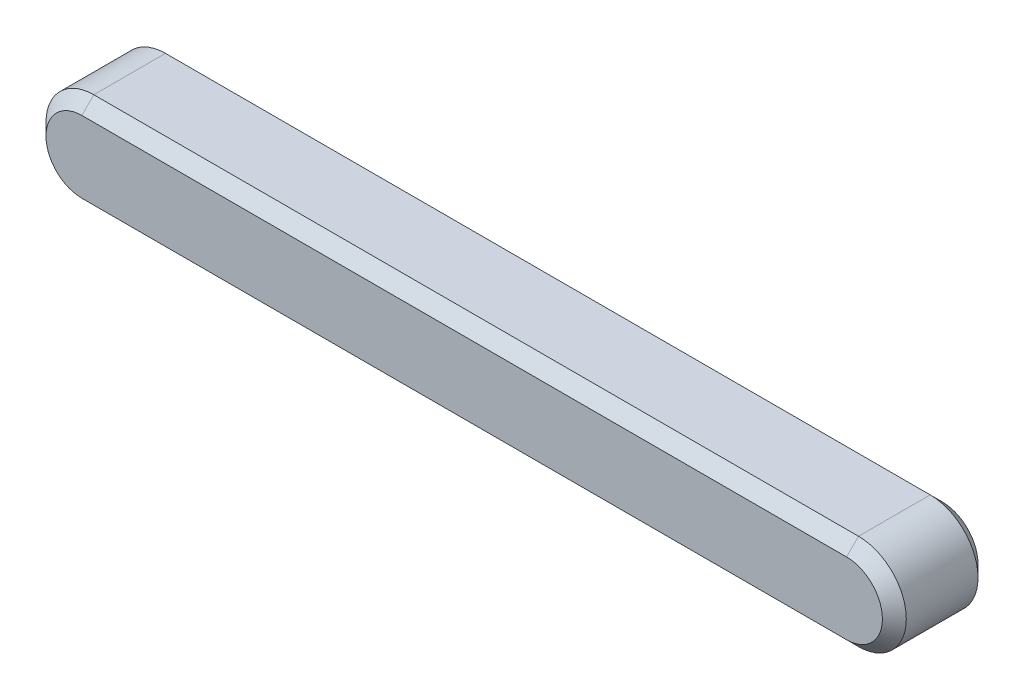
SolidWorks part; units mm, degrees
ref_plane "Front" through (0, 0, 0) normal (0, 0, 1) x (1, 0, 0)
ref_plane "Top" through (0, 0, 0) normal (0, 1, 0) x (1, 0, 0)
ref_plane "Right" through (0, 0, 0) normal (1, 0, 0) x (0, 0, -1)
other "Configuration Table"
sketch "body" plane through (0, 0, 0) normal (0, 0, 1) x (1, 0, 0)
  line L1 (0, 0) -> (16, 0)
  line L3 (0, 2) -> (16, 2)
  arc A0 (16, 0) -> (16, 2) centre (16, 1) ccw
  arc A1 (0, 0) -> (0, 2) centre (0, 1) cw
  dimension "Width" = 2
  dimension "Length" = 18
extrude "Extrude1" add sketch "body" along normal blind 2
chamfer "Chamfer1" distance 0.25 8 edges at (-1, 1, 0) (8, 0, 0) (17, 1, 0) (8, 2, 0) (-1, 1, 2) (8, 0, 2) (17, 1, 2) (8, 2, 2)
